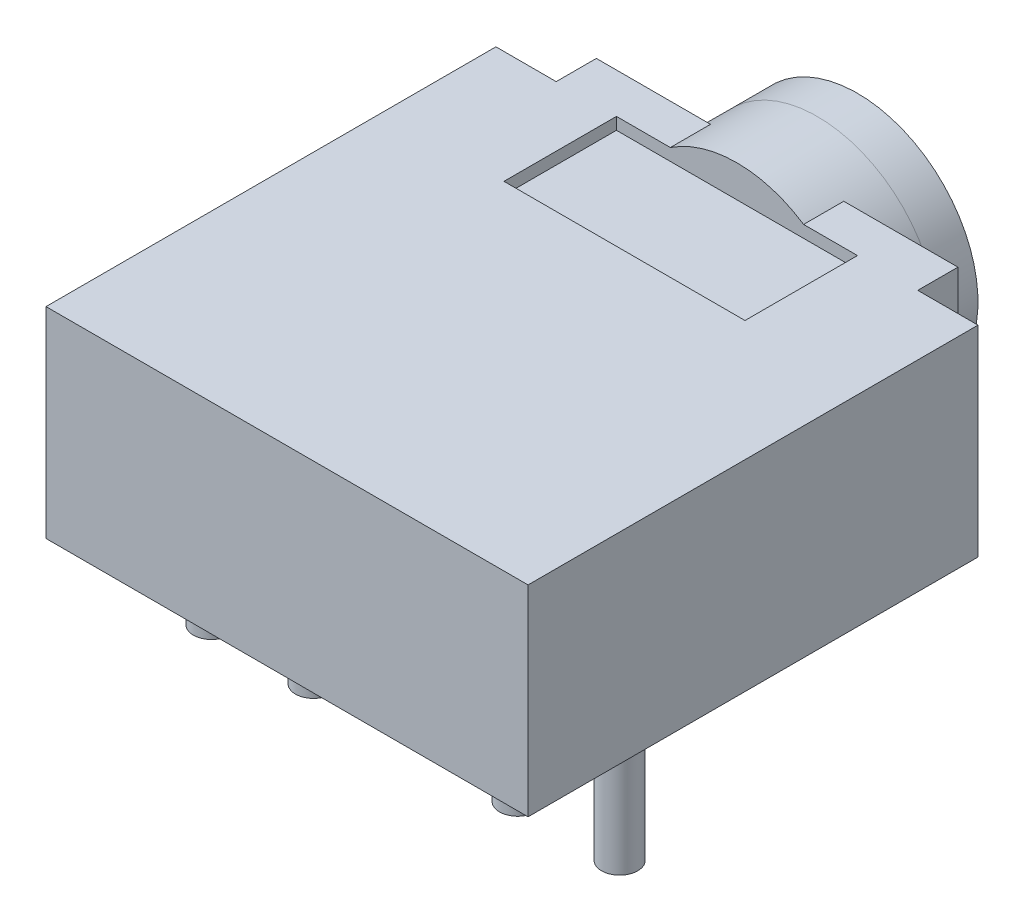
SolidWorks part; units mm, degrees
ref_plane "Plan de face" through (0, 0, 0) normal (0, 0, 1) x (1, 0, 0)
ref_plane "Plan de dessus" through (0, 0, 0) normal (0, 1, 0) x (1, 0, 0)
ref_plane "Plan de droite" through (0, 0, 0) normal (1, 0, 0) x (0, 0, -1)
sketch "Esquisse2" plane through (0, 0, 0) normal (0, 1, 0) x (1, 0, 0)
  line L0 (-26.5307, 0) -> (15.76, 0) construction
  line L1 (0, -13.1531) -> (0, 26.4246) construction
  line L2 (-6, -1.6309) -> (-6, 14.6257) construction
  line L3 (-14.1936, 11.2) -> (2.8301, 11.2) construction
  line L4 (-4.5, 14.6257) -> (-4.5, 9.6009) construction
  line L5 (-14.1936, 12.2) -> (2.8301, 12.2) construction
  line L6 (4.5, 12.2) -> (-4.5, 12.2)
  line L7 (-4.5, 12.2) -> (-4.5, 11.2)
  line L8 (-4.5, 11.2) -> (-6, 11.2)
  line L9 (-6, 11.2) -> (-6, 0)
  line L10 (-6, 0) -> (6, 0)
  line L11 (6, 11.2) -> (6, 0)
  line L12 (4.5, 12.2) -> (4.5, 11.2)
  line L13 (4.5, 11.2) -> (6, 11.2)
  point P19 (0, 0)
  point P22 (0, 12.2)
  dimension "D1" = 6
  dimension "D2" = 11.2
  dimension "D3" = 1
  dimension "D4" = 1.5
extrude "Extrusion1" add sketch "Esquisse2" along normal blind 5
sketch "Esquisse3" plane through (0, 5, 0) normal (0, 1, 0) x (-1, 0, 0)
  line L0 (6.9861, -11.2) -> (-6.9563, -11.2) construction
  line L1 (4.5, -12.6099) -> (4.5, -6.1967) construction
  line L2 (3, -12.6099) -> (3, -6.1967) construction
  line L3 (-4.5, -12.7587) -> (-4.5, -6.1967) construction
  line L4 (-3, -12.7587) -> (-3, -6.1967) construction
  line L5 (4.2036, -8.4) -> (-4.2036, -8.4) construction
  line L7 (3, -11.2) -> (-3, -11.2)
  line L8 (3, -11.2) -> (3, -8.4)
  line L9 (3, -8.4) -> (-3, -8.4)
  line L10 (-3, -11.2) -> (-3, -8.4)
  dimension "D1" = 1.5
  dimension "D2" = 1.5
  dimension "D3" = 2.8
extrude "Enlèv. mat.-Extru.1" cut sketch "Esquisse3" against normal blind 0.3
sketch "Esquisse5" plane through (0, 0, -11.2) normal (0, 0, -1) x (-1, 0, 0)
  line L0 (0, -2.3125) -> (0, 9.7065) construction
  line L1 (6.6039, 5) -> (-7.6299, 5) construction
  line L2 (-7.6299, 2.5) -> (6.6039, 2.5) construction
  circle A0 centre (0, 2.5) radius 3
  dimension "D1" = 2.5
extrude "Extrusion2" add sketch "Esquisse5" along normal blind 2
sketch "Esquisse6" plane through (0, 0, -13.2) normal (0, 0, -1) x (-1, 0, 0)
  line L0 (0, -1.4075) -> (0, 7.595) construction
  line L1 (-6.4408, 5) -> (6.7349, 5) construction
  line L2 (-6.4408, 2.5) -> (6.9724, 2.5) construction
  circle A0 centre (0, 2.5) radius 2.999
  dimension "D1" = 2.5
extrude "Extrusion3" add sketch "Esquisse6" along normal blind 1
sketch "Esquisse7" plane through (0, 0, -14.2) normal (0, 0, -1) x (-1, 0, 0)
  line L0 (0, -1.8493) -> (0, 5.7634) construction
  line L1 (-6.5438, 2.5) -> (6.2723, 2.5) construction
  line L2 (6.3359, 5) -> (-6.5438, 5) construction
  circle A0 centre (0, 2.5) radius 1.75
  dimension "D1" = 2.5
extrude "Enlèv. mat.-Extru.2" cut sketch "Esquisse7" against normal blind 10
sketch "Esquisse8" plane through (0, 0, 0) normal (0, -1, 0) x (1, 0, 0)
  line L0 (8.9302, -12.2) -> (-7.3861, -12.2) construction
  line L1 (-8.1314, -3.31) -> (9.1878, -3.31) construction
  line L2 (0, 2.4337) -> (0, -14.8677) construction
  line L3 (-5.08, 2.4337) -> (-5.08, -4.3085) construction
  line L4 (-2.54, 0.9421) -> (-2.54, -4.3085) construction
  line L5 (-6, 2.4337) -> (-6, -12.5815) construction
  line L6 (-6.6765, -8.39) -> (3.5764, -8.39) construction
  circle A0 centre (-5.08, -3.2) radius 0.45
  circle A1 centre (-2.54, -3.2) radius 0.45
  circle A2 centre (0, -8.39) radius 0.45
  circle A3 centre (5.08, -3.2) radius 0.45
  circle A4 centre (2.54, -3.2) radius 0.45
  dimension "D1" = 3.81
  dimension "D2" = 5.08
  dimension "D3" = 5.08
  dimension "D4" = 2.54
extrude "Extrusion4" add sketch "Esquisse8" along normal blind 3
